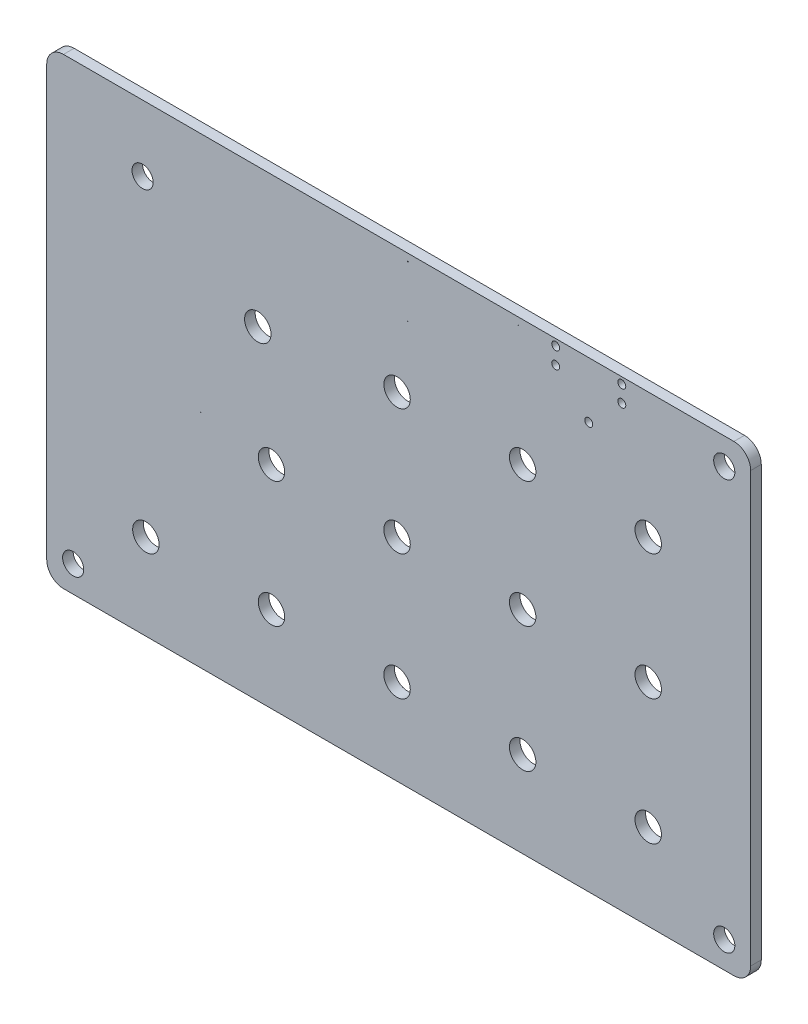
SolidWorks part; units mm, degrees
ref_plane "Front Plane" through (0, 0, 0) normal (0, 0, 1) x (1, 0, 0)
ref_plane "Top Plane" through (0, 0, 0) normal (0, 1, 0) x (1, 0, 0)
ref_plane "Right Plane" through (0, 0, 0) normal (1, 0, 0) x (0, 0, -1)
sketch "Model" plane through (0, 0, 0) normal (0, 0, 1) x (1, 0, 0)
  line L0 (0, 67.46) -> (0, 2.54)
  line L1 (2.54, 0) -> (103.96, 0)
  line L2 (106.5, 2.54) -> (106.5, 67.46)
  line L3 (103.96, 70) -> (2.54, 70)
  line L525 (5.5, 66.5) -> (23.28, 66.5)
  line L526 (23.28, 66.5) -> (23.28, 33.48)
  line L527 (23.28, 33.48) -> (5.5, 33.48)
  line L528 (5.5, 33.48) -> (5.5, 66.5)
  line L1192 (71.35, 68.8985) -> (54.65, 68.8985)
  line L1193 (71.35, 61.1) -> (54.65, 61.1)
  line L1194 (71.35, 68.8985) -> (71.35, 61.1)
  line L1195 (54.65, 68.8985) -> (54.65, 61.1)
  arc A0 (0, 2.54) -> (2.54, 0) centre (2.54, 2.54) ccw
  arc A1 (103.96, 0) -> (106.5, 2.54) centre (103.96, 2.54) ccw
  arc A2 (106.5, 67.46) -> (103.96, 70) centre (103.96, 67.46) ccw
  arc A3 (2.54, 70) -> (0, 67.46) centre (2.54, 67.46) ccw
  circle A4 centre (77, 66.525) radius 0.6
  circle A5 centre (77, 69.025) radius 0.6
  circle A6 centre (87, 69.025) radius 0.6
  circle A7 centre (87, 66.525) radius 0.6
  circle A8 centre (82, 61.525) radius 0.6
  circle A9 centre (31.9337, 49.0191) radius 2.0002
  circle A10 centre (53, 51) radius 2.0002
  circle A11 centre (72, 51) radius 2.0002
  circle A12 centre (91, 51) radius 2.0002
  circle A13 centre (34, 32) radius 2.0002
  circle A14 centre (53, 32) radius 2.0002
  circle A15 centre (72, 32) radius 2.0002
  circle A16 centre (91, 32) radius 2.0002
  circle A17 centre (34, 13) radius 2.0002
  circle A18 centre (53, 13) radius 2.0002
  circle A19 centre (72, 13) radius 2.0002
  circle A20 centre (91, 13) radius 2.0002
  circle A21 centre (15, 13) radius 2.0002
  circle A74 centre (14.5, 60) radius 1.5
  circle A75 centre (102.5, 4) radius 1.5
  circle A76 centre (4, 4) radius 1.5
  circle A77 centre (102.5, 66) radius 1.5
  arc A1120 (23.28, 66.4682) -> (23.28, 66.5318) centre (23.28, 66.5) ccw
  arc A1121 (5.5, 66.5318) -> (5.5, 66.4682) centre (5.5, 66.5) ccw
  arc A1122 (23.2483, 33.48) -> (23.3117, 33.48) centre (23.28, 33.48) ccw
  arc A1123 (23.3117, 66.5) -> (23.2483, 66.5) centre (23.28, 66.5) ccw
  arc A1124 (5.5, 33.5118) -> (5.5, 33.4483) centre (5.5, 33.4801) ccw
  arc A1125 (23.28, 33.4483) -> (23.28, 33.5118) centre (23.28, 33.4801) ccw
  arc A1126 (5.5317, 66.5) -> (5.4683, 66.5) centre (5.5, 66.5) ccw
  arc A1127 (5.4683, 33.48) -> (5.5317, 33.48) centre (5.5, 33.48) ccw
  arc A2454 (54.65, 68.9493) -> (54.65, 68.8477) centre (54.65, 68.8985) ccw
  arc A2455 (71.35, 68.8477) -> (71.35, 68.9493) centre (71.35, 68.8985) ccw
  arc A2456 (54.65, 61.1508) -> (54.65, 61.0492) centre (54.65, 61.1) ccw
  arc A2457 (71.35, 61.0492) -> (71.35, 61.1508) centre (71.35, 61.1) ccw
  arc A2458 (71.2992, 61.1) -> (71.4008, 61.1) centre (71.35, 61.1) ccw
  arc A2459 (71.4008, 68.8985) -> (71.2992, 68.8985) centre (71.35, 68.8985) ccw
  arc A2460 (54.5992, 61.1) -> (54.7008, 61.1) centre (54.65, 61.1) ccw
  arc A2461 (54.7008, 68.8985) -> (54.5992, 68.8985) centre (54.65, 68.8985) ccw
  circle A3860 centre (14.5, 60) radius 1.6
  circle A3861 centre (102.5, 4) radius 1.6
  circle A3862 centre (4, 4) radius 1.6
  circle A3863 centre (102.5, 66) radius 1.6
extrude "Boss-Extrude1" add sketch "Model" along normal blind 1.6
